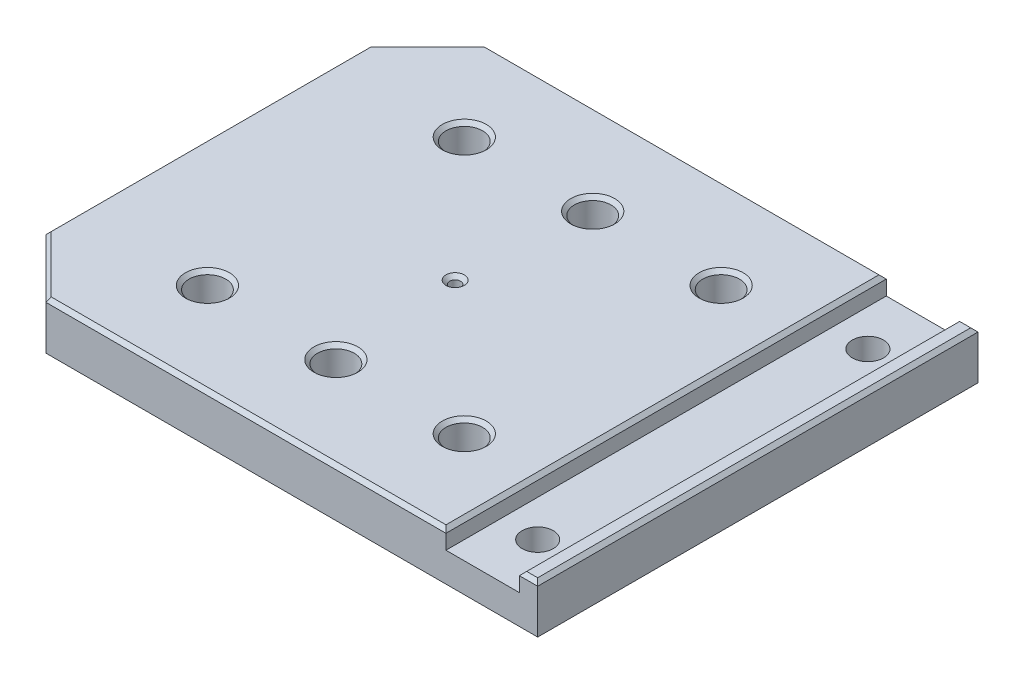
SolidWorks part; units mm, degrees
ref_plane "Front" through (0, 0, 0) normal (0, 0, 1) x (1, 0, 0)
ref_plane "Top" through (0, 0, 0) normal (0, 1, 0) x (1, 0, 0)
ref_plane "Right" through (0, 0, 0) normal (1, 0, 0) x (0, 0, -1)
sketch "Sketch1" plane through (0, 0, 0) normal (0, 1, 0) x (1, 0, 0)
  line L1 (-150, 60) -> (0, 60)
  line L2 (-150, 60) -> (-150, -60)
  line L3 (-150, -60) -> (0, -60)
  line L4 (0, 60) -> (0, -60)
  dimension "D1" = 120
  dimension "D2" = 150
extrude "Boss-Extrude1" add sketch "Sketch1" along normal blind 14
sketch "Sketch2" plane through (0, 14, 0) normal (0, 1, 0) x (1, 0, 0)
  line L0 (0, 60) -> (-150, 60) construction
  line L1 (-25, 60) -> (-5, 60)
  line L2 (-25, 60) -> (-25, -60)
  line L3 (-25, -60) -> (-5, -60)
  line L4 (-5, 60) -> (-5, -60)
  line L5 (-150, -60) -> (0, -60) construction
  line L6 (0, -60) -> (0, 60) construction
  dimension "D1" = 20
  dimension "D2" = 5
extrude "Cut-Extrude1" cut sketch "Sketch2" against normal blind 5
sketch "Sketch3" plane through (0, 0, 0) normal (0, -1, 0) x (1, 0, 0)
  line L0 (-15, 60) -> (-15, 45) construction
  line L1 (-15, 45) -> (-15, -45) construction
  line L2 (-15, -45) -> (-15, -60) construction
  line L3 (0, -60) -> (-150, -60) construction
  line L4 (-25, 60) -> (-5, 60) construction
  circle A0 centre (-15, 45) radius 4.25
  circle A1 centre (-15, -45) radius 4.25
  dimension "D2" = 8.5
  dimension "D1" = 90
extrude "Cut-Extrude2" cut sketch "Sketch3" against normal through all
chamfer "Chamfer1" distance 16 angle 45 2 edges at (-150, 7, -60) (-150, 7, 60)
sketch "Sketch4" plane through (0, 0, 0) normal (0, -1, 0) x (1, 0, 0)
  line L0 (-115, 35) -> (-45, 35) construction
  line L1 (-115, 43) -> (-45, 43)
  line L2 (-115, 27) -> (-45, 27)
  line L3 (0, 60) -> (0, -60) construction
  line L4 (-134, 60) -> (0, 60) construction
  arc A0 (-115, 43) -> (-115, 27) centre (-115, 35) ccw
  arc A1 (-45, 27) -> (-45, 43) centre (-45, 35) ccw
  point P2 (-80, 35)
  dimension "D1" = 16
  dimension "D2" = 70
  dimension "D3" = 45
  dimension "D4" = 25
extrude "Cut-Extrude3" cut sketch "Sketch4" against normal blind 5
sketch "Sketch5" plane through (0, 5, 0) normal (0, -1, 0) x (1, 0, 0)
  line L0 (-80, 43) -> (-80, 27) construction
  line L1 (-45, 43) -> (-115, 43) construction
  line L2 (-115, 27) -> (-45, 27) construction
  circle A0 centre (-115, 35) radius 5
  circle A1 centre (-45, 35) radius 5
  circle A2 centre (-80, 35) radius 5
  dimension "D1" = 10
extrude "Cut-Extrude4" cut sketch "Sketch5" against normal up to next
mirror "Mirror1" about plane through (0, 0, 0) normal (0, 0, 1) of "Cut-Extrude4", "Cut-Extrude3"
sketch "Sketch7" plane through (0, 0, 0) normal (0, -1, 0) x (1, 0, 0)
  line L0 (0, 60) -> (0, -60) construction
  line L1 (-125, 15) -> (-40, 15)
  line L2 (-125, 15) -> (-125, -15)
  line L3 (-125, -15) -> (-40, -15)
  line L4 (-40, 15) -> (-40, -15)
  line L5 (-125, 15) -> (-40, -15) construction
  line L6 (-125, -15) -> (-40, 15) construction
  point P0 (-82.5, 0)
  dimension "D1" = 40
  dimension "D2" = 85
  dimension "D3" = 30
extrude "Cut-Extrude6" cut sketch "Sketch7" against normal blind 3
fillet "Fillet1" radius 5 4 edges at (-125, 1.5, -15) (-40, 1.5, -15) (-40, 1.5, 15) (-125, 1.5, 15)
sketch "Sketch8" plane through (0, 3, 0) normal (0, -1, 0) x (1, 0, 0)
  line L0 (-82.5, 15) -> (-82.5, -15) construction
  line L1 (-45, 15) -> (-120, 15) construction
  line L2 (-120, -15) -> (-45, -15) construction
  circle A0 centre (-82.5, 0) radius 1.5
  dimension "D1" = 3
extrude "Cut-Extrude7" cut sketch "Sketch8" against normal through all
other "Fill Pattern1" [suppressed] parameters "D4"=6, "D5"=6, "D3"=0, "D7"=7, "D8"=33
chamfer "Chamfer2" distance 1 angle 45 41 edges at (-2.5, 14, -60) (0, 14, 0) (-2.5, 14, 60) (-5, 14, 0) (-80, 14, -30) (-115, 14, -30) (-80, 14, 40) (-45, 14, 40) (-115, 14, 40) (-25, 14, 0) (-79.5, 14, 60) (-142, 14, 52) (-150, 14, 0) (-142, 14, -52) (-79.5, 14, -60) (-45, 14, -30) (-80, 0, -43) (-37, 0, -35) (-80, 0, -27) (-123, 0, -35) (-37, 0, 35) (-80, 0, 43) (-123, 0, 35) (-80, 0, 27) (-15, 0, -49.25) (-15, 0, 40.75) (-142, 0, 52) (-67, 0, 60) (0, 0, 0) (-67, 0, -60) (-142, 0, -52) (-150, 0, 0) (-82.5, 14, -1.5) (-123.5355, 0, 13.5355) (-125, 0, 0) (-123.5355, 0, -13.5355) (-82.5, 0, -15) (-41.4645, 0, -13.5355) (-40, 0, 0) (-41.4645, 0, 13.5355) (-82.5, 0, 15)
